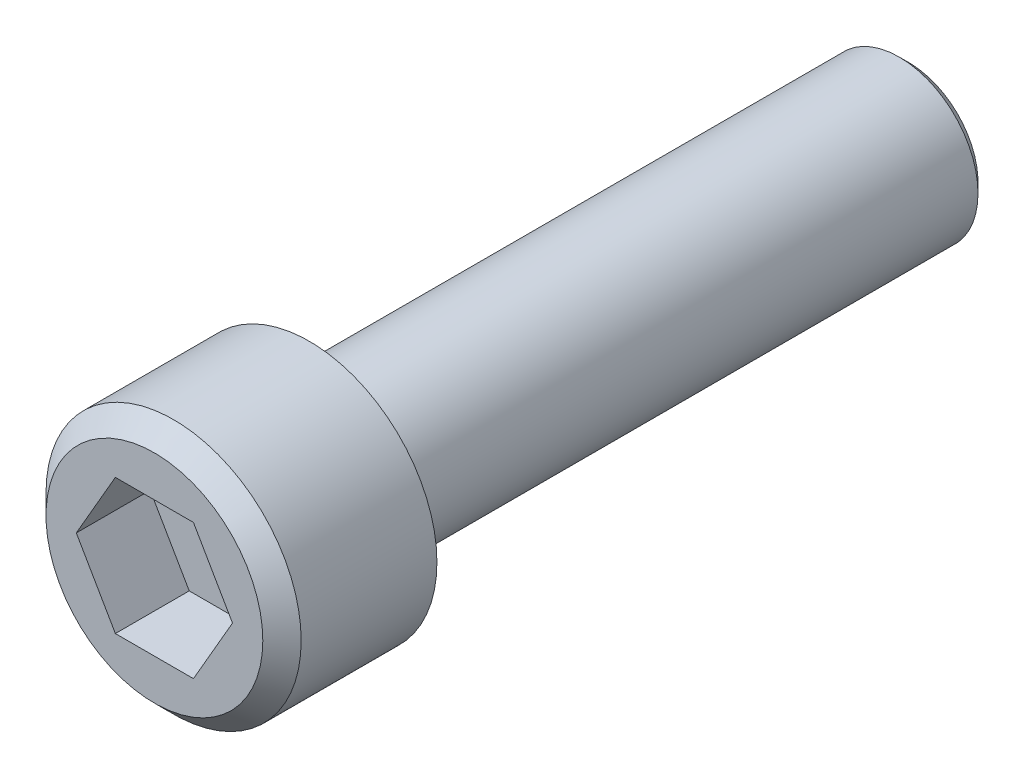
SolidWorks part; units mm, degrees
ref_plane "Plane1" through (0, 0, 0) normal (0, 0, 1) x (1, 0, 0)
ref_plane "Plane2" through (0, 0, 0) normal (0, 1, 0) x (1, 0, 0)
ref_plane "Plane3" through (0, 0, 0) normal (1, 0, 0) x (0, 0, -1)
sketch "Sketch1" plane through (0, 0, 0) normal (0, 0, 1) x (1, 0, 0)
  circle A0 centre (0, 0) radius 3.3782
  dimension "Head Dia." = 6.7564
extrude "Head" add sketch "Sketch1" against normal blind 4.1021
sketch "Sketch2" plane through (0, 0, -4.1021) normal (0, 0, -1) x (-1, 0, 0)
  circle A0 centre (0, 0) radius 2.0828
  dimension "Shaft O.D." = 4.1656
extrude "Shank" add sketch "Sketch2" along normal blind 15.875
sketch "Sketch3" plane through (0, 0, 0) normal (0, 0, 1) x (1, 0, 0)
  line L1 (2.0677, 0) -> (1.0339, 1.7907)
  line L2 (1.0339, 1.7907) -> (-1.0339, 1.7907)
  line L3 (-1.0339, 1.7907) -> (-2.0677, 0)
  line L4 (-2.0677, 0) -> (-1.0339, -1.7907)
  line L5 (-1.0339, -1.7907) -> (1.0339, -1.7907)
  line L6 (1.0339, -1.7907) -> (2.0677, 0)
  circle A0 centre (0, 0) radius 1.7907 construction
  dimension "Socket Size" = 3.5814
extrude "Socket" cut sketch "Sketch3" against normal blind 1.9558
chamfer "Bottom Chamfer" distance 0.254 angle 45 1 edges at (-2.0828, 0, -19.9771)
chamfer "Top Chamfer" distance 0.508 angle 45 1 edges at (3.3782, 0, 0)
